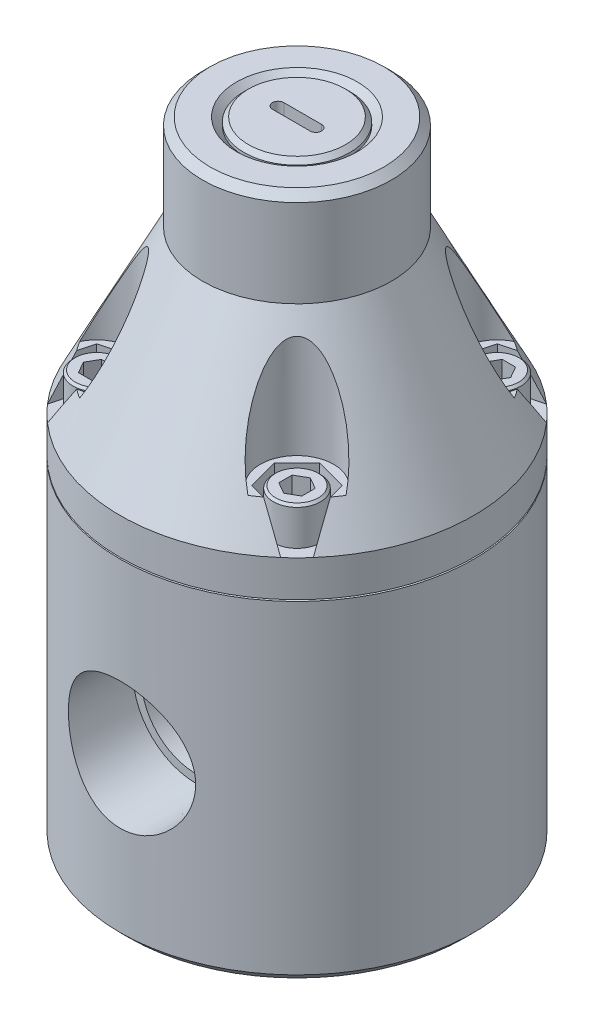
SolidWorks part; units mm, degrees
ref_plane "Front Plane" through (0, 0, 0) normal (0, 0, 1) x (1, 0, 0)
ref_plane "Top Plane" through (0, 0, 0) normal (0, 1, 0) x (1, 0, 0)
ref_plane "Right Plane" through (0, 0, 0) normal (1, 0, 0) x (0, 0, -1)
sketch "Sketch1" plane through (0, 0, 0) normal (0, 1, 0) x (1, 0, 0)
  circle A0 centre (0, 0) radius 29.718
  dimension "D1" = 59.436
extrude "Extrude1" add sketch "Sketch1" along normal blind 105.41
sketch "Sketch2" plane through (0, 0, 0) normal (0, 0, 1) x (1, 0, 0)
  line L0 (0, 0) -> (0, 105.41) construction
  line L1 (29.718, 105.41) -> (-29.718, 105.41) construction
  line L2 (-29.718, 55.88) -> (-20.6255, 55.88)
  line L3 (-29.718, 105.41) -> (-29.718, 0) construction
  line L4 (-20.6255, 55.88) -> (-20.6255, 56.134)
  line L5 (-20.6255, 56.134) -> (-29.718, 56.134)
  line L6 (-29.718, 56.134) -> (-29.718, 62.23)
  line L7 (-29.718, 62.23) -> (-15.875, 89.408)
  line L8 (-15.875, 89.408) -> (-15.875, 105.41)
  line L9 (-15.875, 105.41) -> (-21.1252, 108.0842)
  line L10 (-21.1252, 108.0842) -> (-34.3087, 108.0842)
  line L11 (-34.3087, 108.0842) -> (-34.3087, 59.0996)
  line L12 (-34.3087, 59.0996) -> (-29.718, 55.88)
  line L13 (-29.718, 0) -> (29.718, 0) construction
  dimension "D1" = 55.88
  dimension "D2" = 0.254
  dimension "D3" = 29.718
  dimension "D4" = 6.35
  dimension "D5" = 27.178
  dimension "D6" = 15.875
revolve "Cut-Revolve1" cut sketch "Sketch2" angle 360 about L0
ref_plane "Plane1" through (0, 105.41, 0) normal (0, 1, 0) x (-1, 0, 0)
sketch "Sketch3" plane through (0, 105.41, 0) normal (0, 1, 0) x (-1, 0, 0)
  circle A0 centre (0, 0) radius 10.16
  dimension "D1" = 20.32
extrude "Extrude2" cut sketch "Sketch3" against normal blind 1.27 draft 45
ref_plane "Plane2" through (0, 0, 29.718) normal (0, 0, 1) x (1, 0, 0)
sketch "Sketch4" plane through (0, 0, 29.718) normal (0, 0, 1) x (1, 0, 0)
  line L0 (0, 0) -> (0, 55.88) construction
  line L1 (29.718, 55.88) -> (-29.718, 55.88) construction
  line L2 (29.718, 27.432) -> (-29.718, 27.432) construction
  line L6 (29.718, 0) -> (29.718, 55.88) construction
  line L7 (-29.718, 55.88) -> (-29.718, 0) construction
  line L8 (-29.718, 0) -> (29.718, 0) construction
  circle A0 centre (0, 27.432) radius 10.7315
  dimension "D2" = 21.463
  dimension "D1" = 27.432
chamfer "Chamfer1" distance 1.27 angle 45 1 edges at (0, 105.41, -15.875)
chamfer "Chamfer2" distance 1.524 angle 45 1 edges at (0, 0, 29.718)
sketch "Sketch6" plane through (0, 105.41, 0) normal (0, 1, 0) x (-1, 0, 0)
  circle A0 centre (0, 0) radius 8.89
extrude "Extrude3" add sketch "Sketch6" against normal up to surface (1.27 mm away)
chamfer "Chamfer3" distance 0.762 angle 45 1 edges at (0, 105.41, 8.89)
sketch "Sketch7" plane through (0, 105.41, 0) normal (0, 1, 0) x (-1, 0, 0)
  line L0 (0, 0) -> (-3.175, 0) construction
  line L1 (-3.175, 0.9652) -> (3.175, 0.9652)
  line L2 (3.175, -0.9652) -> (-3.175, -0.9652)
  arc A0 (-3.175, 0.9652) -> (-3.175, -0.9652) centre (-3.175, 0) ccw
  arc A1 (3.175, -0.9652) -> (3.175, 0.9652) centre (3.175, 0) ccw
  dimension "D1" = 3.175
  dimension "D2" = 6.35
  dimension "D3" = 0.9652
  dimension "D4" = 0.9652
extrude "Extrude4" cut sketch "Sketch7" against normal blind 4.7498
ref_plane "Plane3" through (0, 68.58, 0) normal (0, 1, 0) x (-1, 0, 0)
sketch "Sketch8" plane through (0, 68.58, 0) normal (0, 1, 0) x (-1, 0, 0)
  line L0 (0, 0) -> (0, -29.718) construction
  line L1 (0, 0) -> (-21.0138, -21.0138) construction
  circle A1 centre (0, 0) radius 29.718 construction
  circle A2 centre (0, 0) radius 23.8125 construction
  circle A3 centre (-16.838, -16.838) radius 6.1722
  dimension "D2" = 47.625
  dimension "D3" = 12.3444
  dimension "D1" = 45
extrude "Extrude5" cut sketch "Sketch8" along normal blind 21.0058
pattern_circular "CirPattern2" count 4 over 360 about axis through (0, 0, 0) along (0, 1, 0) of "Extrude5"
sketch "Sketch9" plane through (0, 68.58, 0) normal (0, 1, 0) x (-1, 0, 0)
  line L0 (0, 0) -> (0, -29.718) construction
  line L1 (0, 0) -> (-21.0138, -21.0138) construction
  line L2 (-16.838, -16.838) -> (-21.0138, -12.6622) construction
  line L5 (-20.6332, -13.0427) -> (-23.298, -23.298)
  line L7 (-13.0427, -20.6332) -> (-11.6536, -15.4488)
  line L8 (-11.6536, -15.4488) -> (-15.4488, -11.6536)
  line L9 (-15.4488, -11.6536) -> (-20.6332, -13.0427)
  line L10 (-22.0224, -18.2271) -> (-18.2271, -22.0224)
  line L11 (-23.298, -23.298) -> (-13.0427, -20.6332)
  line L13 (-20.6332, -13.0427) -> (-22.0224, -18.2271)
  line L14 (-18.2271, -22.0224) -> (-13.0427, -20.6332)
  circle A0 centre (0, 0) radius 29.718 construction
  circle A1 centre (0, 0) radius 23.8125 construction
  circle A2 centre (-16.838, -16.838) radius 4.6482 construction
  circle A3 centre (-16.838, -16.838) radius 4.6482 construction
  dimension "D1" = 9.2964
extrude "Extrude6" cut sketch "Sketch9" against normal blind 6.35
pattern_circular "CirPattern3" count 4 over 360 about axis through (0, 0, 0) along (0, 1, 0) of "Extrude6"
sketch "Sketch10" plane through (0, 68.58, 0) normal (0, 1, 0) x (-1, 0, 0)
  circle A0 centre (-16.838, -16.838) radius 3.9624
  dimension "D1" = 7.9248
extrude "Extrude7" add sketch "Sketch10" against normal up to surface (6.35 mm away)
sketch "Sketch11" plane through (0, 68.58, 0) normal (0, 1, 0) x (-1, 0, 0)
  line L1 (-19.0755, -16.838) -> (-17.9568, -18.7758)
  line L2 (-17.9568, -18.7758) -> (-15.7192, -18.7758)
  line L3 (-15.7192, -18.7758) -> (-14.6004, -16.838)
  line L4 (-14.6004, -16.838) -> (-15.7192, -14.9002)
  line L5 (-15.7192, -14.9002) -> (-17.9568, -14.9002)
  line L6 (-17.9568, -14.9002) -> (-19.0755, -16.838)
  circle A0 centre (-16.838, -16.838) radius 1.9378 construction
extrude "Extrude8" cut sketch "Sketch11" against normal blind 3.175
pattern_circular "CirPattern4" count 4 over 360 about axis through (0, 0, 0) along (0, 1, 0) of "Extrude7", "Extrude8"
chamfer "Chamfer5" distance 0.381 angle 45 4 edges at (16.838, 68.58, -12.8756) (12.8756, 68.58, 16.838) (-16.838, 68.58, 12.8756) (-12.8756, 68.58, -16.838)
extrude "Extrude10" cut sketch "Sketch4" against normal blind 12.7 draft 1
sketch "Sketch12" plane through (0, 0, 29.718) normal (0, 0, 1) x (1, 0, 0)
  circle A0 centre (0, 27.432) radius 9.1186
  dimension "D1" = 18.2372
extrude "Extrude11" cut sketch "Sketch12" against normal blind 15.875
pattern_circular "CirPattern5" count 2 over 360 about axis through (0, 105.41, 0) along (0, -1, 0) of "Extrude10", "Extrude11"
sketch "Sketch13" plane through (0, 0, 0) normal (0, 1, 0) x (1, 0, 0)
  circle A0 centre (0, 0) radius 10.7315
  dimension "D1" = 21.463
extrude "Extrude12" cut sketch "Sketch13" along normal blind 13.97 draft 1
sketch "Sketch14" plane through (0, 0, 0) normal (0, 1, 0) x (1, 0, 0)
  circle A0 centre (0, 0) radius 9.1186
  dimension "D1" = 18.2372
extrude "Extrude13" cut sketch "Sketch14" along normal blind 15.875
